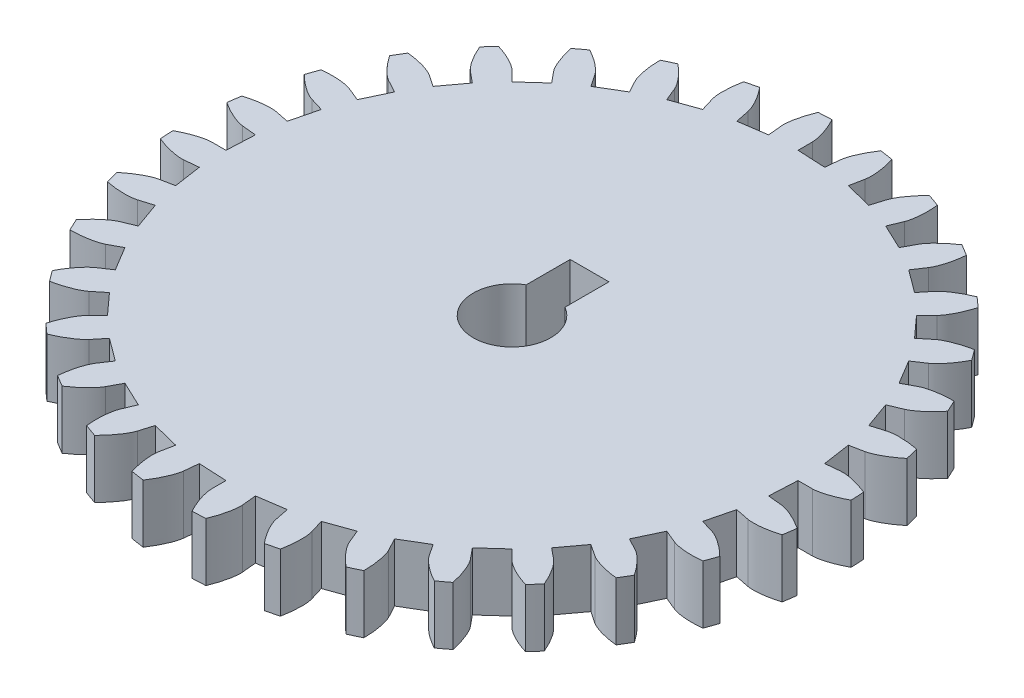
SolidWorks part; units mm, degrees
ref_plane "Front Plane" through (0, 0, 0) normal (0, 0, 1) x (1, 0, 0)
ref_plane "Top Plane" through (0, 0, 0) normal (0, 1, 0) x (1, 0, 0)
ref_plane "Right Plane" through (0, 0, 0) normal (1, 0, 0) x (0, 0, -1)
sketch "Sketch1" plane through (0, 0, 0) normal (0, 1, 0) x (1, 0, 0)
  line L0 (0, 0) -> (0, 7.7452) construction
  line L1 (0, 0) -> (-7.7452, 0) construction
  line L2 (0, 0) -> (-8.4898, -0.4171) construction
  line L3 (0, 0) -> (-7.7079, -0.7592) construction
  line L4 (0, 0) -> (-7.5964, -1.511) construction
  circle A0 centre (0, 0) radius 8 construction
  circle A1 centre (0, 0) radius 7.7452 construction
  circle A2 centre (0, 0) radius 7.375 construction
  circle A3 centre (0, 0) radius 8.5 construction
  spline S0 degree 4 poles (-7.7452, 0) (-7.7558, 0) (-7.7855, -0.0011) (-7.8414, -0.0075) (-7.9319, -0.0239) (-8.0454, -0.0537) (-8.1894, -0.1021) (-8.3547, -0.1717) (-8.5311, -0.2609) (-8.7164, -0.3713) (-8.8947, -0.493) (-9.0658, -0.6245) (-9.2299, -0.7647) (-9.4205, -0.9443) (-9.6374, -1.1739) (-9.8724, -1.4599) (-10.116, -1.8066) (-10.338, -2.1774) (-10.5345, -2.5612) (-10.7061, -2.9584) (-10.8534, -3.3625) (-10.9771, -3.779) (-11.0649, -4.1415) (-11.1265, -4.4669) (-11.168, -4.7213) (-11.1969, -4.9568) (-11.224, -5.1833) (-11.2488, -5.5647) (-11.2576, -5.8025) (-11.2587, -6.1731) (-11.2517, -6.3082) (-11.2484, -6.4164) knots 0 0 0 0 0 0.005377 0.015084 0.028532 0.04661 0.064855 0.092111 0.119476 0.146842 0.174209 0.201575 0.228941 0.256307 0.307035 0.361767 0.4165 0.471232 0.525964 0.580697 0.635429 0.690161 0.744894 0.77226 0.799626 0.826992 0.854358 0.909091 0.954545 1 1 1 1 1 construction
  spline S1 degree 4 poles (-7.7452, 0) (-7.7558, 0) (-7.7855, -0.0011) (-7.8414, -0.0075) (-7.9319, -0.0239) (-8.0454, -0.0537) (-8.1894, -0.1021) (-8.3547, -0.1717) (-8.5311, -0.2609) (-8.7164, -0.3713) (-8.8947, -0.493) (-9.0658, -0.6245) (-9.2299, -0.7647) (-9.4205, -0.9443) (-9.6374, -1.1739) (-9.8724, -1.4599) (-10.116, -1.8066) (-10.338, -2.1774) (-10.5345, -2.5612) (-10.7061, -2.9584) (-10.8534, -3.3625) (-10.9771, -3.779) (-11.0649, -4.1415) (-11.1265, -4.4669) (-11.168, -4.7213) (-11.1969, -4.9568) (-11.224, -5.1833) (-11.2415, -5.4528) (-11.2489, -5.5975) (-11.2521, -5.6955) knots 0 0 0 0 0 0.005377 0.015084 0.028532 0.04661 0.064855 0.092111 0.119476 0.146842 0.174209 0.201575 0.228941 0.256307 0.307035 0.361767 0.4165 0.471232 0.525964 0.580697 0.635429 0.690161 0.744894 0.77226 0.799626 0.826992 0.854358 0.909091 0.909091 0.909091 0.909091 0.909091
  dimension "D1" = 17
  dimension "D2" = 16
  dimension "D3" = 15.4904
  dimension "D4" = 14.75
  dimension "D5" = 7.7452
  dimension "D6" = 2.813
  dimension "D7" = 5.625
  dimension "D8" = 11.25
sketch "Sketch2" plane through (0, 0, 0) normal (0, 1, 0) x (1, 0, 0)
  line L0 (0, 0) -> (-8.4898, -0.4171) construction
  line L1 (0, 0) -> (-8.4898, -0.4171) construction
  line L2 (0, 0) -> (-7.7079, -0.7592) construction
  line L3 (0, 0) -> (-7.7452, 0) construction
  line L4 (0, 0) -> (-7.5964, -1.511) construction
  line L5 (0, 0) -> (-7.7079, -0.7592) construction
  line L6 (0, 0) -> (-7.7452, 0) construction
  line L7 (0, 0) -> (-7.5964, -1.511) construction
  line L8 (-7.7079, -0.7592) -> (-7.3395, -0.7229)
  line L9 (-7.3395, -0.7229) -> (-7.2333, -1.4388)
  line L10 (-7.2333, -1.4388) -> (-7.5964, -1.511) construction
  line L11 (-7.2333, -1.4388) -> (-0.9808, -0.1951)
  line L12 (-7.7452, 0) -> (-1, 0)
  circle A0 centre (0, 0) radius 7.375 construction
  circle A1 centre (0, 0) radius 7.7452 construction
  circle A2 centre (0, 0) radius 8 construction
  circle A3 centre (0, 0) radius 8.5 construction
  circle A4 centre (0, 0) radius 7.375 construction
  circle A5 centre (0, 0) radius 7.7452 construction
  circle A6 centre (0, 0) radius 8 construction
  circle A7 centre (0, 0) radius 8.5 construction
  arc A8 (-8.4796, -0.5883) -> (-8.4964, -0.2457) centre (0, 0) cw
  circle A11 centre (0, 0) radius 1 construction
  arc A12 (-1, 0) -> (-0.9808, -0.1951) centre (0, 0) ccw
  spline S0 degree 4 poles (-70.8844, -1998.7894) (-5.8416, -33.8641) (-5.9676, -0.6475) (-7.0092, 0.1439) (-7.9319, -0.0239) (-8.0454, -0.0537) (-8.1894, -0.1021) (-8.3547, -0.1717) (-8.5311, -0.2609) (-8.7164, -0.3713) (-8.8947, -0.493) (-9.0658, -0.6245) (-9.2299, -0.7647) (-9.4205, -0.9443) (-9.6374, -1.1739) (-9.8724, -1.4599) (-10.116, -1.8066) (-10.338, -2.1774) (-10.5345, -2.5612) (-10.7061, -2.9584) (-10.8534, -3.3625) (-10.9771, -3.779) (-11.0649, -4.1415) (-11.1265, -4.4669) (-11.168, -4.7213) (-11.1969, -4.9568) (-11.3662, -6.3731) (-11.2939, -12.7918) (-7.782, 75.5755) (-76.1929, -2004.4995) knots -0.42896 -0.42896 -0.42896 -0.42896 -0.42896 0.005377 0.015084 0.028532 0.04661 0.064855 0.092111 0.119476 0.146842 0.174209 0.201575 0.228941 0.256307 0.307035 0.361767 0.4165 0.471232 0.525964 0.580697 0.635429 0.690161 0.744894 0.77226 0.799626 0.826992 0.854358 1.627679 1.627679 1.627679 1.627679 1.627679 only from (-7.7452, 0) to (-11.2521, -5.6955) construction
  spline S1 degree 4 poles (-7.7452, 0) (-7.7558, 0) (-7.7855, -0.0011) (-7.8414, -0.0075) (-7.9319, -0.0239) (-8.0454, -0.0537) (-8.1894, -0.1021) (-8.3212, -0.1575) (-8.4178, -0.2043) (-8.4809, -0.2374) (-8.4964, -0.2457) knots 0 0 0 0 0 0.005377 0.015084 0.028532 0.04661 0.064855 0.092111 0.101035 0.101035 0.101035 0.101035 0.101035
  spline S2 degree 4 poles (-7.7079, -0.7592) (-7.7184, -0.7602) (-7.7481, -0.762) (-7.8044, -0.7612) (-7.896, -0.7537) (-8.0119, -0.7352) (-8.1599, -0.7011) (-8.2966, -0.6588) (-8.3973, -0.6218) (-8.4634, -0.595) (-8.4796, -0.5883) knots 0 0 0 0 0 0.005377 0.015084 0.028532 0.04661 0.064855 0.092111 0.101035 0.101035 0.101035 0.101035 0.101035
  point P21 (-7.3395, -0.7229)
  point P24 (-7.2333, -1.4388)
  dimension "D2" = 2
extrude "Boss-Extrude1" add sketch "Sketch2" along normal blind 1.5
pattern_circular "CirPattern1" count 32 over 360 of "Boss-Extrude1"
sketch "Sketch3" plane through (0, 1.5, 0) normal (0, 1, 0) x (1, 0, 0)
  line L1 (0.5, 0) -> (-0.5, 0)
  line L2 (0.5, 0) -> (0.5, 2)
  line L3 (0.5, 2) -> (-0.5, 2)
  line L4 (-0.5, 0) -> (-0.5, 2)
  line L5 (0.5, 0) -> (-0.5, 2) construction
  line L6 (0.5, 2) -> (-0.5, 0) construction
  circle A0 centre (0, 0) radius 1 construction
  point P0 (0, 1)
  dimension "D1" = 2
  dimension "D2" = 1
extrude "Cut-Extrude1" cut sketch "Sketch3" against normal up to surface (1.5 mm away)
equation "\"Module\"= .5"
equation "\"Number of Teeth\"= 32"
equation "\"Pressure Angle\"= 14.5deg"
equation "\"Pitch Diameter\"= \"Number of Teeth\" * \"Module\""
equation "\"Circular Pitch\"= pi * \"Module\""
equation "\"Addendum\"= \"Module\""
equation "\"Dedendum\"= 1.25 * \"Module\""
equation "\"Base Diameter\"= \"Pitch Diameter\" * cos ( \"Pressure Angle\" )"
equation "\"Base Radius\"= \"Base Diameter\" / 2"
equation "\"Width\"= 1.5"
equation "\"Outside Diameter\"= \"Pitch Diameter\" + 2 * \"Addendum\""
equation "\"D1@Sketch1\"=\"Outside Diameter\""
equation "\"D3@Sketch1\"=\"Base Diameter\""
equation "\"Root Diameter\"= \"Pitch Diameter\" - 2 * \"Dedendum\""
equation "\"D4@Sketch1\"=\"Root Diameter\""
equation "\"Tooth Angle\"= 360 / \"Number of Teeth\""
equation "\"D6@Sketch1\"=\"Tooth Angle\"/4"
equation "\"D7@Sketch1\"=\"Tooth Angle\"/2"
equation "\"D8@Sketch1\"=\"Tooth Angle\""
equation "\"D2@Sketch1\" = \"Pitch Diameter\""
equation "\"Shaft Diameter\" = 2"
equation "\"D1@CirPattern1\" = \"Number of Teeth\""
equation "\"D2@Sketch2\"= \"Shaft Diameter\""
equation "\"D1@Boss-Extrude1\" = \"Width\""
